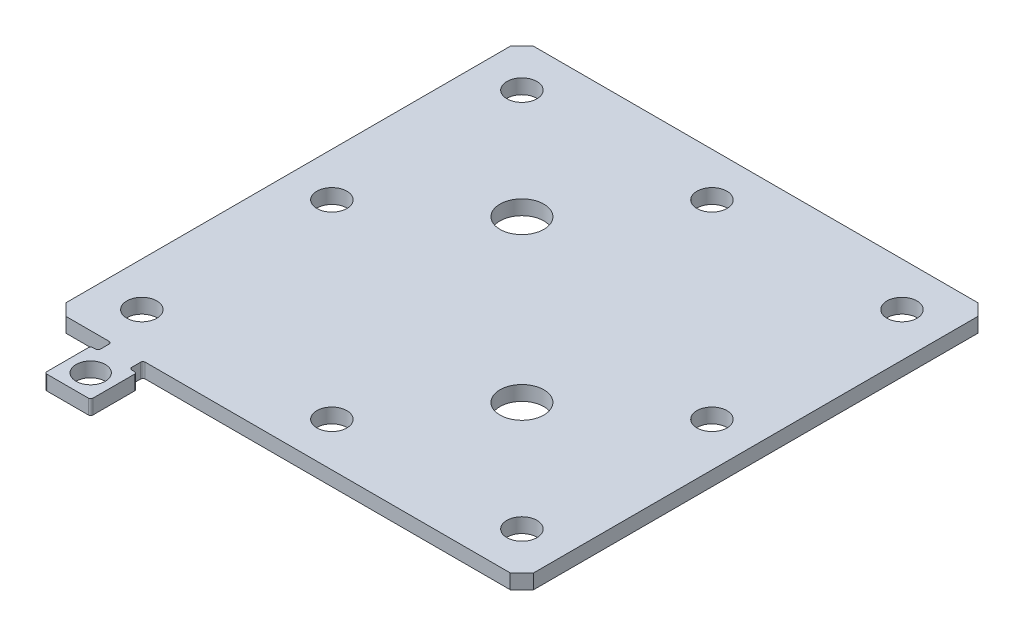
SolidWorks part; units mm, degrees
ref_plane "Front Plane" through (0, 0, 0) normal (0, 0, 1) x (1, 0, 0)
ref_plane "Top Plane" through (0, 0, 0) normal (0, 1, 0) x (1, 0, 0)
ref_plane "Right Plane" through (0, 0, 0) normal (1, 0, 0) x (0, 0, -1)
sketch "Sketch1" plane through (0, 0, 0) normal (0, 1, 0) x (1, 0, 0)
  line L0 (-51.4236, 48.8836) -> (-48.8836, 51.4236)
  line L1 (-48.8836, -50.1764) -> (-38.9611, -50.1764)
  line L2 (-51.4236, -47.6364) -> (-51.4236, 48.8836)
  line L3 (-48.8836, 51.4236) -> (47.6364, 51.4236)
  line L4 (50.1764, -47.6364) -> (50.1764, 48.8836)
  line L5 (-51.4236, -50.1764) -> (50.1764, 51.4236) construction
  line L6 (-51.4236, 51.4236) -> (50.1764, -50.1764) construction
  line L7 (47.6364, 51.4236) -> (50.1764, 48.8836)
  line L8 (47.6364, -50.1764) -> (50.1764, -47.6364)
  line L9 (-51.4236, -47.6364) -> (-48.8836, -50.1764)
  line L10 (-41.8986, 41.8986) -> (-0.6236, 41.8986)
  line L11 (40.6514, -40.6514) -> (-41.8986, -40.6514) construction
  line L12 (40.6514, -40.6514) -> (40.6514, 41.8986) construction
  line L13 (40.6514, 41.8986) -> (-41.8986, 41.8986) construction
  line L14 (-41.8986, -40.6514) -> (-41.8986, 41.8986) construction
  line L15 (40.6514, -40.6514) -> (-41.8986, 41.8986) construction
  line L16 (40.6514, 41.8986) -> (-41.8986, -40.6514) construction
  line L17 (40.6514, -40.6514) -> (-0.6236, -40.6514)
  line L18 (-35.5486, -34.3014) -> (34.3014, -34.3014)
  line L19 (-35.5486, -34.3014) -> (-35.5486, 35.5486)
  line L20 (-35.5486, 35.5486) -> (34.3014, 35.5486)
  line L21 (34.3014, -34.3014) -> (34.3014, 35.5486)
  line L22 (-35.5486, -34.3014) -> (34.3014, 35.5486) construction
  line L23 (-35.5486, 35.5486) -> (34.3014, -34.3014) construction
  line L24 (-35.5486, -53.1144) -> (-35.5486, -63.1144) construction
  line L25 (-40.5486, -53.1144) -> (-38.9611, -53.1144)
  line L26 (-40.5486, -53.1144) -> (-40.5486, -63.1144)
  line L27 (-40.5486, -63.1144) -> (-30.5486, -63.1144)
  line L28 (-30.5486, -53.1144) -> (-30.5486, -63.1144)
  line L29 (-38.9611, -53.1144) -> (-38.9611, -50.1764)
  line L30 (-32.1361, -53.1144) -> (-32.1361, -50.1764)
  line L31 (-32.1361, -53.1144) -> (-30.5486, -53.1144)
  line L32 (-32.1361, -50.1764) -> (47.6364, -50.1764)
  circle A0 centre (-41.8986, 41.8986) radius 3.2639
  circle A1 centre (-0.6236, 41.8986) radius 3.2639
  circle A2 centre (40.6514, 41.8986) radius 3.2639
  circle A3 centre (40.6514, 0.6236) radius 3.2639
  circle A4 centre (40.6514, -40.6514) radius 3.2639
  circle A5 centre (-0.6236, -40.6514) radius 3.2639
  circle A6 centre (-41.8986, -40.6514) radius 3.2639
  circle A7 centre (-41.8986, 0.6236) radius 3.2639
  circle A8 centre (-21.2611, 41.8986) radius 4.7625 construction
  circle A9 centre (20.0139, -40.6514) radius 4.7625 construction
  point P0 (-0.6236, 0.6236)
  point P13 (-0.6236, 0.6236)
  point P34 (-0.6236, 0.6236)
  dimension "D13" = 6.5278
  dimension "D14" = 9.525
  dimension "D1" = 101.6
  dimension "D2" = 101.6
  dimension "D3" = 2.54
  dimension "D4" = 2.54
  dimension "D5" = 2.54
  dimension "D6" = 2.54
  dimension "D7" = 2.54
  dimension "D8" = 2.54
  dimension "D9" = 2.54
  dimension "D10" = 2.54
  dimension "D11" = 82.55
  dimension "D12" = 82.55
  dimension "D15" = 69.85
  dimension "D16" = 69.85
  dimension "D17" = 10
  dimension "D18" = 10
  dimension "D19" = 1.5875
extrude "Boss-Extrude1" add sketch "Sketch1" along normal blind 3.175
fillet "Fillet1" radius 0.5 8 edges at (-40.5486, 1.5875, 63.1144) (-30.5486, 1.5875, 63.1144) (-30.5486, 1.5875, 53.1144) (-32.1361, 1.5875, 53.1144) (-32.1361, 1.5875, 50.1764) (-40.5486, 1.5875, 53.1144) (-38.9611, 1.5875, 53.1144) (-38.9611, 1.5875, 50.1764)
sketch "Sketch2" plane through (0, 3.175, 0) normal (0, 1, 0) x (1, 0, 0)
  line L0 (-51.4236, 18.0861) -> (-18.0861, 18.0861) construction
  line L1 (-18.0861, 18.0861) -> (-18.0861, 51.4236) construction
  line L2 (16.8389, -50.1764) -> (16.8389, -16.8389) construction
  line L3 (16.8389, -16.8389) -> (50.1764, -16.8389) construction
  line L4 (-40.0486, -53.6144) -> (-31.0486, -62.6144) construction
  line L5 (-31.0486, -53.6144) -> (-40.0486, -62.6144) construction
  line L16 (-40.5486, -53.6144) -> (-40.5486, -62.6144)
  line L17 (-40.0486, -63.1144) -> (-31.0486, -63.1144)
  line L18 (-30.5486, -62.6144) -> (-30.5486, -53.6144)
  line L19 (-31.0486, -53.1144) -> (-31.6361, -53.1144)
  line L20 (-32.1361, -52.6144) -> (-32.1361, -50.6764)
  line L21 (-31.6361, -50.1764) -> (47.6364, -50.1764)
  line L22 (47.6364, -50.1764) -> (50.1764, -47.6364)
  line L23 (50.1764, -47.6364) -> (50.1764, 48.8836)
  line L24 (50.1764, 48.8836) -> (47.6364, 51.4236)
  line L25 (47.6364, 51.4236) -> (-48.8836, 51.4236)
  line L26 (-48.8836, 51.4236) -> (-51.4236, 48.8836)
  line L27 (-51.4236, 48.8836) -> (-51.4236, -47.6364)
  line L28 (-51.4236, -47.6364) -> (-48.8836, -50.1764)
  line L29 (-48.8836, -50.1764) -> (-39.4611, -50.1764)
  line L30 (-38.9611, -50.6764) -> (-38.9611, -52.6144)
  line L31 (-39.4611, -53.1144) -> (-40.0486, -53.1144)
  line L32 (-40.5486, -53.6144) -> (-40.5486, -62.6144)
  line L33 (-40.0486, -63.1144) -> (-31.0486, -63.1144)
  line L34 (-30.5486, -62.6144) -> (-30.5486, -53.6144)
  line L35 (-31.0486, -53.1144) -> (-31.6361, -53.1144)
  line L36 (-32.1361, -52.6144) -> (-32.1361, -50.6764)
  line L37 (-31.6361, -50.1764) -> (47.6364, -50.1764)
  line L38 (47.6364, -50.1764) -> (50.1764, -47.6364)
  line L39 (50.1764, -47.6364) -> (50.1764, 48.8836)
  line L40 (50.1764, 48.8836) -> (47.6364, 51.4236)
  line L41 (47.6364, 51.4236) -> (-48.8836, 51.4236)
  line L42 (-48.8836, 51.4236) -> (-51.4236, 48.8836)
  line L43 (-51.4236, 48.8836) -> (-51.4236, -47.6364)
  line L44 (-51.4236, -47.6364) -> (-48.8836, -50.1764)
  line L45 (-48.8836, -50.1764) -> (-39.4611, -50.1764)
  line L46 (-38.9611, -50.6764) -> (-38.9611, -52.6144)
  line L47 (-39.4611, -53.1144) -> (-40.0486, -53.1144)
  circle A0 centre (-41.8986, 41.8986) radius 3.2639 construction
  circle A1 centre (-35.5486, -58.1144) radius 3.175
  circle A2 centre (-0.6236, 41.8986) radius 3.2639 construction
  circle A3 centre (40.6514, 41.8986) radius 3.2639 construction
  circle A4 centre (40.6514, 0.6236) radius 3.2639 construction
  circle A5 centre (40.6514, -40.6514) radius 3.2639 construction
  circle A6 centre (-0.6236, -40.6514) radius 3.2639 construction
  circle A7 centre (-41.8986, -40.6514) radius 3.2639 construction
  arc A8 (-40.5486, -62.6144) -> (-40.0486, -63.1144) centre (-40.0486, -62.6144) ccw
  arc A9 (-31.0486, -63.1144) -> (-30.5486, -62.6144) centre (-31.0486, -62.6144) ccw
  arc A10 (-30.5486, -53.6144) -> (-31.0486, -53.1144) centre (-31.0486, -53.6144) ccw
  arc A11 (-32.1361, -52.6144) -> (-31.6361, -53.1144) centre (-31.6361, -52.6144) ccw
  arc A12 (-31.6361, -50.1764) -> (-32.1361, -50.6764) centre (-31.6361, -50.6764) ccw
  arc A13 (-38.9611, -50.6764) -> (-39.4611, -50.1764) centre (-39.4611, -50.6764) ccw
  arc A14 (-39.4611, -53.1144) -> (-38.9611, -52.6144) centre (-39.4611, -52.6144) ccw
  arc A15 (-40.0486, -53.1144) -> (-40.5486, -53.6144) centre (-40.0486, -53.6144) ccw
  arc A16 (-40.5486, -62.6144) -> (-40.0486, -63.1144) centre (-40.0486, -62.6144) ccw
  arc A17 (-31.0486, -63.1144) -> (-30.5486, -62.6144) centre (-31.0486, -62.6144) ccw
  arc A18 (-30.5486, -53.6144) -> (-31.0486, -53.1144) centre (-31.0486, -53.6144) ccw
  arc A19 (-32.1361, -52.6144) -> (-31.6361, -53.1144) centre (-31.6361, -52.6144) ccw
  arc A20 (-31.6361, -50.1764) -> (-32.1361, -50.6764) centre (-31.6361, -50.6764) ccw
  arc A21 (-38.9611, -50.6764) -> (-39.4611, -50.1764) centre (-39.4611, -50.6764) ccw
  arc A22 (-39.4611, -53.1144) -> (-38.9611, -52.6144) centre (-39.4611, -52.6144) ccw
  arc A23 (-40.0486, -53.1144) -> (-40.5486, -53.6144) centre (-40.0486, -53.6144) ccw
  circle A24 centre (-41.8986, 0.6236) radius 3.2639 construction
  circle A25 centre (-41.8986, 0.6236) radius 3.2639
  circle A26 centre (-41.8986, -40.6514) radius 3.2639
  circle A27 centre (-0.6236, -40.6514) radius 3.2639
  circle A28 centre (40.6514, -40.6514) radius 3.2639
  circle A29 centre (40.6514, 0.6236) radius 3.2639
  circle A30 centre (40.6514, 41.8986) radius 3.2639
  circle A31 centre (-0.6236, 41.8986) radius 3.2639
  circle A33 centre (-41.8986, 41.8986) radius 3.2639
  circle A34 centre (-18.0861, 18.0861) radius 4.7625
  circle A35 centre (16.8389, -16.8389) radius 4.7625
  dimension "D6" = 9.525
  dimension "D7" = 9.525
  dimension "D8" = 6.35
  dimension "D2" = 33.3375
  dimension "D3" = 33.3375
  dimension "D4" = 33.3375
  dimension "D5" = 33.3375
  dimension "D1" = 0
extrude "Cut-Extrude2" cut sketch "Sketch2" against normal through all contours A34 | A35 | A1
